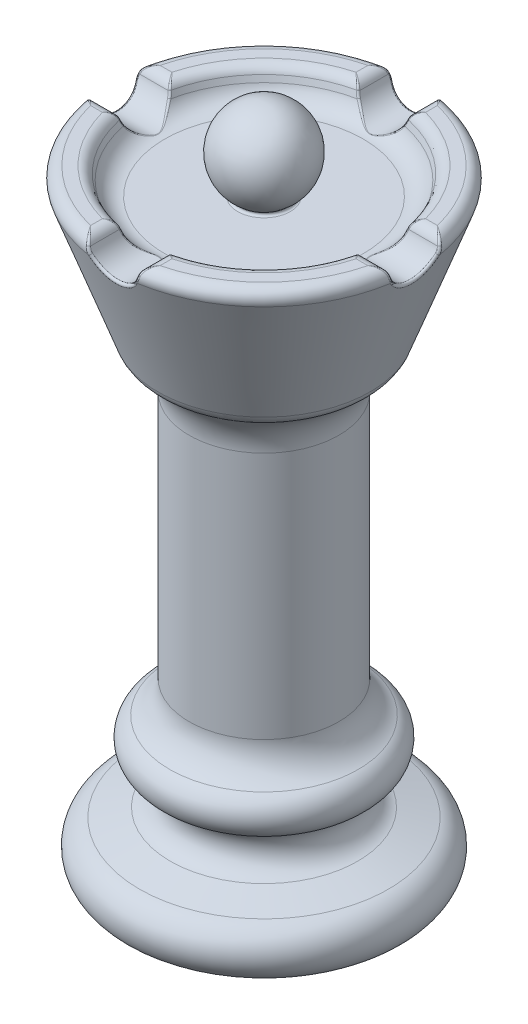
SolidWorks part; units mm, degrees
ref_plane "Front" through (0, 0, 0) normal (0, 0, 1) x (1, 0, 0)
ref_plane "Top" through (0, 0, 0) normal (0, 1, 0) x (1, 0, 0)
ref_plane "Right" through (0, 0, 0) normal (1, 0, 0) x (0, 0, -1)
sketch "Sketch1" plane through (0, 0, 0) normal (0, 0, 1) x (1, 0, 0)
  line L0 (0, 0) -> (0, 72.0534) construction
  line L1 (0, 0) -> (13.97, 0)
  line L2 (14.8003, 5.9807) -> (11.1344, 7.0186)
  line L3 (8.89, 20.2472) -> (8.89, 49.7112)
  line L4 (12.6183, 56.0518) -> (18.796, 73.025)
  line L5 (18.796, 73.025) -> (14.732, 73.025)
  line L6 (0, 69.85) -> (0, 0)
  line L7 (14.732, 73.025) -> (14.1847, 71.5213)
  line L8 (11.7979, 69.85) -> (0, 69.85)
  arc A0 (13.97, 0) -> (14.8003, 5.9807) centre (13.97, 3.048) ccw
  arc A1 (11.1344, 7.0186) -> (10.941, 11.8433) centre (11.8263, 9.4625) cw
  arc A2 (10.941, 11.8433) -> (11.2008, 16.4912) centre (10.0557, 14.224) ccw
  arc A3 (11.2008, 16.4912) -> (8.89, 20.2472) centre (13.0979, 20.2472) cw
  arc A4 (8.89, 49.7112) -> (11.6298, 54.8002) centre (14.986, 49.7112) cw
  arc A5 (11.7979, 69.85) -> (14.1847, 71.5213) centre (11.7979, 72.39) ccw
  arc A6 (12.6183, 56.0518) -> (11.6298, 54.8002) centre (10.2315, 56.9206) cw
  dimension "D2" = 3.048
  dimension "D4" = 2.54
  dimension "D5" = 2.54
  dimension "D7" = 8.89
  dimension "D8" = 4.064
  dimension "D9" = 3.175
  dimension "D11" = 6.096
  dimension "D12" = 14.224
  dimension "D13" = 29.464
  dimension "D14" = 13.97
  dimension "D15" = 11.8263
  dimension "D16" = 4.2079
  dimension "D3" = 3.81
  dimension "D6" = 69.85
  dimension "D10" = 110
  dimension "D17" = 18.796
revolve "Base-Revolve" add sketch "Sketch1" angle 360 about L0
sketch "Sketch2" plane through (0, 73.025, 0) normal (0, 1, 0) x (-1, 0, 0)
  line L0 (0, 0) -> (0, 21.3897) construction
  line L2 (0, 18.796) -> (-3.048, 18.796)
  line L3 (0, 18.796) -> (0, 12.446)
  line L4 (0, 12.446) -> (-3.048, 12.446)
  line L5 (-3.048, 18.796) -> (-3.048, 12.446)
  circle A1 centre (0, 0) radius 18.796 construction
  dimension "D1" = 3.048
  dimension "D2" = 6.35
revolve "Cut-Revolve1" cut sketch "Sketch2" angle 360 about L0
pattern_circular "CirPattern1" count 4 over 360 about axis through (0, 0, 0) along (0, 1, 0) of "Cut-Revolve1"
sketch "Sketch3" plane through (0, 0, 0) normal (0, 0, 1) x (1, 0, 0)
  line L0 (0, 69.9924) -> (0, 86.3357) construction
  line L2 (0, 0) -> (0, 72.0534) construction
  line L3 (0, 79.502) -> (0, 69.342)
  line L4 (11.7979, 69.85) -> (-11.7979, 69.85) construction
  arc A0 (0, 69.342) -> (0, 79.502) centre (0, 74.422) ccw
  dimension "D1" = 5.08
  dimension "D2" = 4.572
revolve "Boss-Revolve1" add sketch "Sketch3" angle 360 about L0
fillet "Fillet1" radius 1.27 24 edges at (-10.4171, 73.025, 10.4171) (-13.2908, 73.025, 13.2908) (3.048, 73.025, 16.4802) (-0.4065, 70.0042, 17.6919) (-3.048, 73.025, 16.4802) (-2.8751, 72.0129, 14.073) (10.4171, 73.025, 10.4171) (13.2908, 73.025, 13.2908) (16.4802, 73.025, -3.048) (17.6919, 70.0042, 0.4065) (16.4802, 73.025, 3.048) (14.073, 72.0129, 2.8751) (10.4171, 73.025, -10.4171) (13.2908, 73.025, -13.2908) (-3.048, 73.025, -16.4802) (0.4065, 70.0042, -17.6919) (3.048, 73.025, -16.4802) (2.8751, 72.0129, -14.073) (-10.4171, 73.025, -10.4171) (-13.2908, 73.025, -13.2908) (-16.4802, 73.025, 3.048) (-17.6919, 70.0042, -0.4065) (-16.4802, 73.025, -3.048) (-14.073, 72.0129, -2.8751)
fillet "Fillet2" radius 0.254 49 edges at (-3.3775, 72.7802, 17.4071) (3.3775, 72.7802, 17.4071) (-3.4085, 72.8022, 14.5078) (3.4085, 72.8022, 14.5078) (14.5078, 72.8022, 3.4085) (14.5078, 72.8022, -3.4085) (17.4071, 72.7802, 3.3775) (17.4071, 72.7802, -3.3775) (3.4085, 72.8022, -14.5078) (-3.4085, 72.8022, -14.5078) (3.3775, 72.7802, -17.4071) (-3.3775, 72.7802, -17.4071) (-14.5078, 72.8022, -3.4085) (-14.5078, 72.8022, 3.4085) (-17.4071, 72.7802, 3.3775) (-17.4071, 72.7802, -3.3775) (-0.1631, 69.9814, 12.6031) (2.7718, 71.7572, 18.0406) (-0.4065, 70.0042, 17.6919) (-2.7424, 71.6947, 18.0436) (17.6919, 70.0042, 0.4065) (18.0436, 71.6947, 2.7424) (12.6031, 69.9814, 0.1631) (18.0406, 71.7572, -2.7718) (0.4065, 70.0042, -17.6919) (2.7424, 71.6947, -18.0436) (0.1631, 69.9814, -12.6031) (-2.7718, 71.7572, -18.0406) (-18.0436, 71.6947, -2.7424) (-12.6031, 69.9814, -0.1631) (-18.0406, 71.7572, 2.7718) (-17.6919, 70.0042, -0.4065) (0, 69.85, 2.2143)
